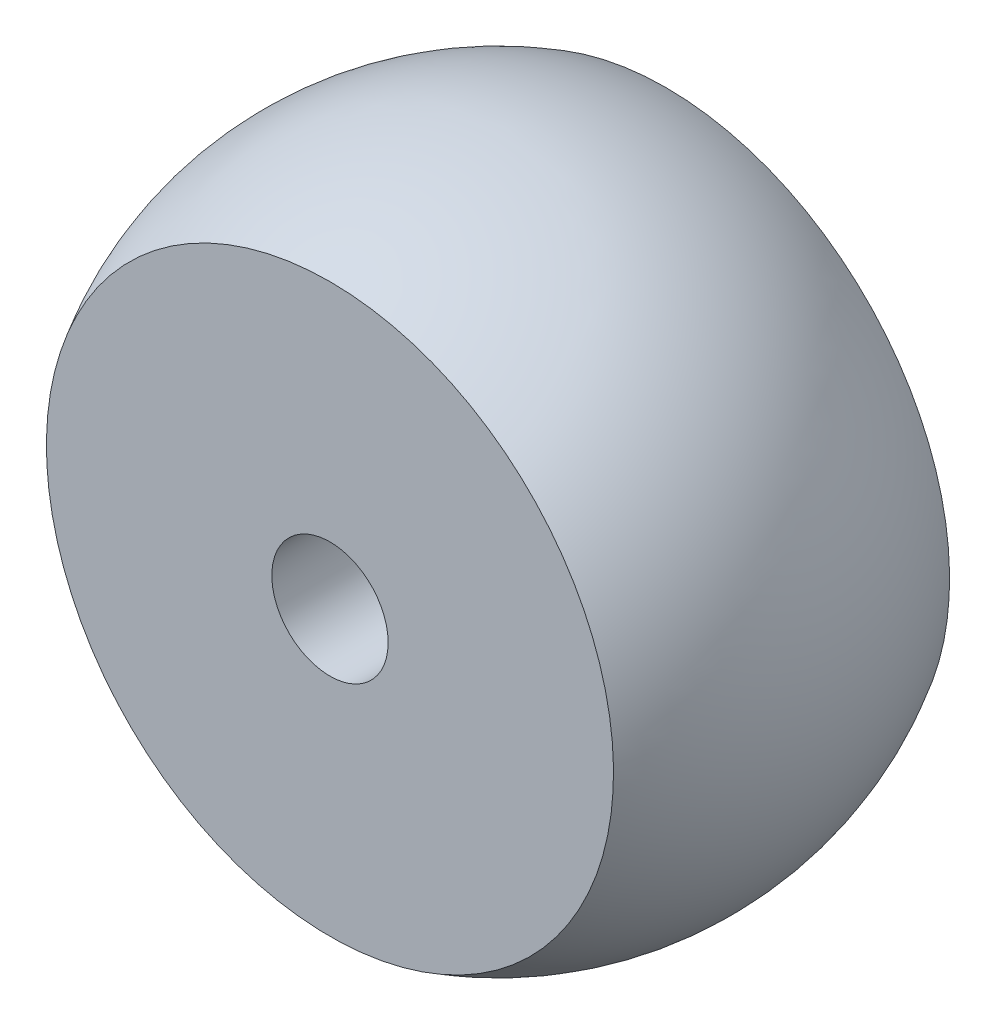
SolidWorks part; units mm, degrees
ref_plane "Ebene vorne" through (0, 0, 0) normal (0, 0, 1) x (1, 0, 0)
ref_plane "Ebene oben" through (0, 0, 0) normal (0, 1, 0) x (1, 0, 0)
ref_plane "Ebene rechts" through (0, 0, 0) normal (1, 0, 0) x (0, 0, -1)
sketch "Skizze1" plane through (0, 0, 0) normal (0, 0, 1) x (1, 0, 0)
  circle A0 centre (0, 0) radius 12.75
  dimension "D1" = 25.5
extrude "Aufsatz-Linear austragen1" add sketch "Skizze1" along normal mid plane 13
sketch "Skizze2" plane through (0, 0, 0) normal (0, 0, 1) x (1, 0, 0)
  circle A0 centre (0, 0) radius 2.25
  dimension "D1" = 4.5
extrude "Schnitt-Linear austragen1" cut sketch "Skizze2" against normal mid plane 13
sketch "Skizze3" plane through (0, 0, 0) normal (1, 0, 0) x (0, 0, -1)
  line L1 (-6.5, 12.75) -> (-6.5, -12.75) construction
  line L4 (6.5, -12.75) -> (6.5, 12.75) construction
  line L5 (-6.5, 10.9687) -> (-6.5, 13.9364)
  line L6 (-6.5, 13.9364) -> (6.5, 13.9364)
  line L7 (6.5, 13.9364) -> (6.5, 10.9687)
  arc A0 (6.5, 10.9687) -> (-6.5, 10.9687) centre (0, 0) ccw
revolve "Schnitt-Rotation2" cut sketch "Skizze3" angle 360 about axis through (0, 0, 6.5) along (0, 0, -1)
